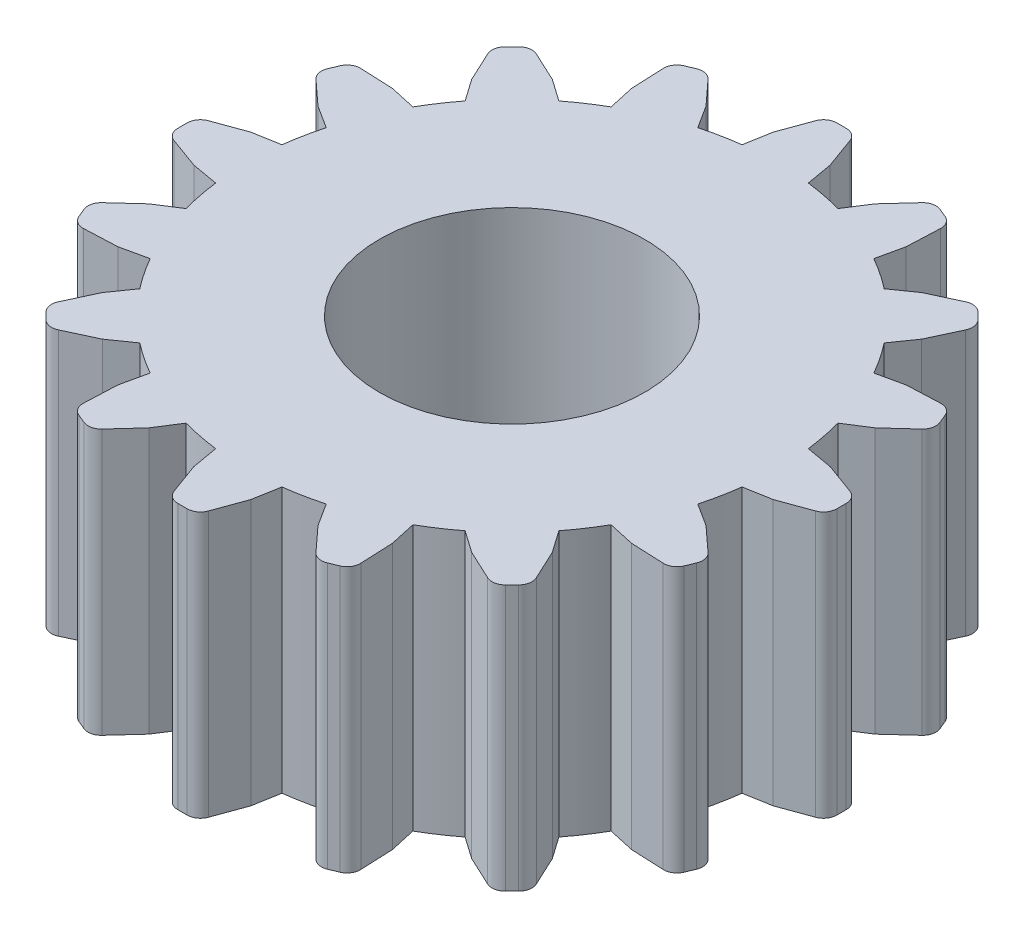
SolidWorks part; units mm, degrees
ref_plane "Front Plane" through (0, 0, 0) normal (0, 0, 1) x (1, 0, 0)
ref_plane "Top Plane" through (0, 0, 0) normal (0, 1, 0) x (1, 0, 0)
ref_plane "Right Plane" through (0, 0, 0) normal (1, 0, 0) x (0, 0, -1)
sketch "Sketch1" plane through (0, 0, 0) normal (0, 1, 0) x (1, 0, 0)
  circle A0 centre (0, 0) radius 25.4
  circle A1 centre (0, 0) radius 12.7
  dimension "D1" = 25.4
  dimension "D2" = 50.8
extrude "Boss-Extrude1" add sketch "Sketch1" along normal blind 25.4
sketch "Sketch2" plane through (0, 25.4, 0) normal (0, 1, 0) x (1, 0, 0)
  line L0 (-3.175, 25.2008) -> (3.175, 25.2008)
  line L1 (3.175, 25.2008) -> (2.7271, 27.7408)
  line L2 (2.7271, 27.7408) -> (1.3404, 31.5508)
  line L3 (1.3404, 31.5508) -> (-1.3404, 31.5508)
  line L4 (-1.3404, 31.5508) -> (-2.7271, 27.7408)
  line L5 (-2.7271, 27.7408) -> (-3.175, 25.2008)
  circle A0 centre (0, 0) radius 25.4 construction
  dimension "D1" = 80
  dimension "D2" = 110
  dimension "D3" = 6.35
  dimension "D4" = 2.54
  dimension "D5" = 3.81
extrude "Boss-Extrude2" add sketch "Sketch2" against normal blind 25.4
fillet "Fillet1" radius 1.27 2 edges at (1.3404, 12.7, -31.5508) (-1.3404, 12.7, -31.5508)
pattern_circular "CirPattern1" count 16 over 360 about axis through (0, 0, 0) along (0, 1, 0) of "Fillet1", "Boss-Extrude2"
